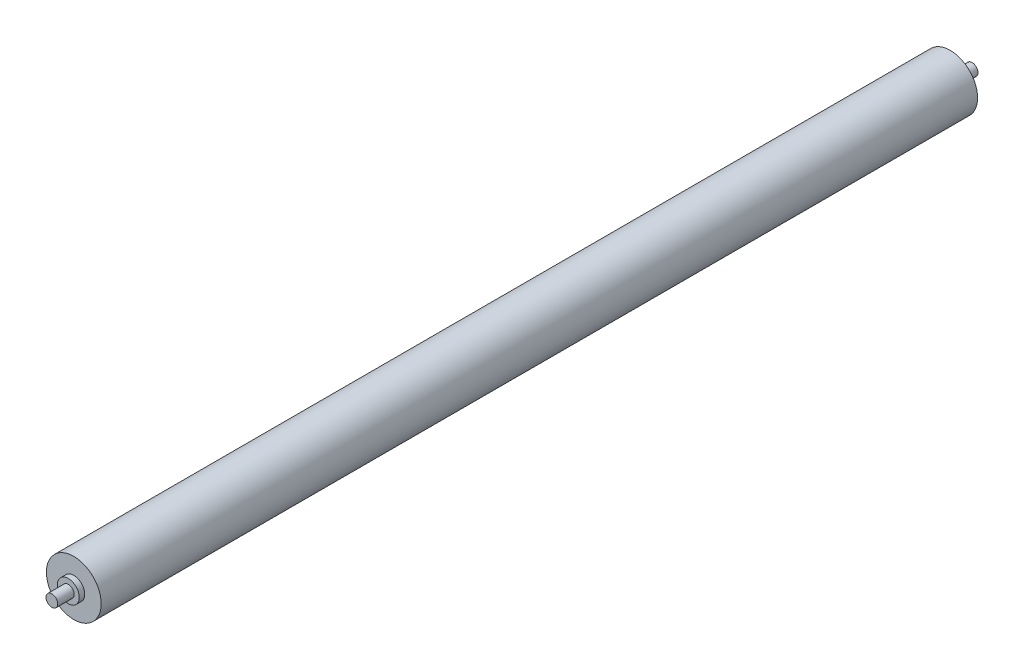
SolidWorks part; units mm, degrees
ref_plane "Ebene1" through (0, 0, 0) normal (0, 0, 1) x (1, 0, 0)
ref_plane "Ebene2" through (0, 0, 0) normal (0, 1, 0) x (1, 0, 0)
ref_plane "Ebene3" through (0, 0, 0) normal (1, 0, 0) x (0, 0, -1)
sketch "Skizze1" plane through (0, 0, 0) normal (0, 0, 1) x (1, 0, 0)
  circle A0 centre (0, 0) radius 5.3731
extrude "Basis-Linear austragen" add sketch "Skizze1" along normal blind 15
sketch "Skizze2" plane through (0, 0, 15) normal (0, 0, 1) x (1, 0, 0)
  circle A0 centre (0, 0) radius 10
  dimension "D1" = 20
extrude "Aufsatz-Linear austragen1" add sketch "Skizze2" along normal blind 5
sketch "Skizze3" plane through (0, 0, 20) normal (0, 0, 1) x (1, 0, 0)
  circle A0 centre (0, 0) radius 25
  dimension "D1" = 50
extrude "Aufsatz-Linear austragen2" add sketch "Skizze3" along normal blind 800
sketch "Skizze5" plane through (0, 0, 820) normal (0, 0, 1) x (1, 0, 0)
  circle A0 centre (0, 0) radius 10 construction
  circle A2 centre (0, 0) radius 10
extrude "Aufsatz-Linear austragen4" add sketch "Skizze5" along normal blind 5
sketch "Skizze6" plane through (0, 0, 825) normal (0, 0, 1) x (1, 0, 0)
  circle A0 centre (0, 0) radius 5.3731 construction
  circle A1 centre (0, 0) radius 5.3731
extrude "Aufsatz-Linear austragen5" add sketch "Skizze6" along normal blind 15
